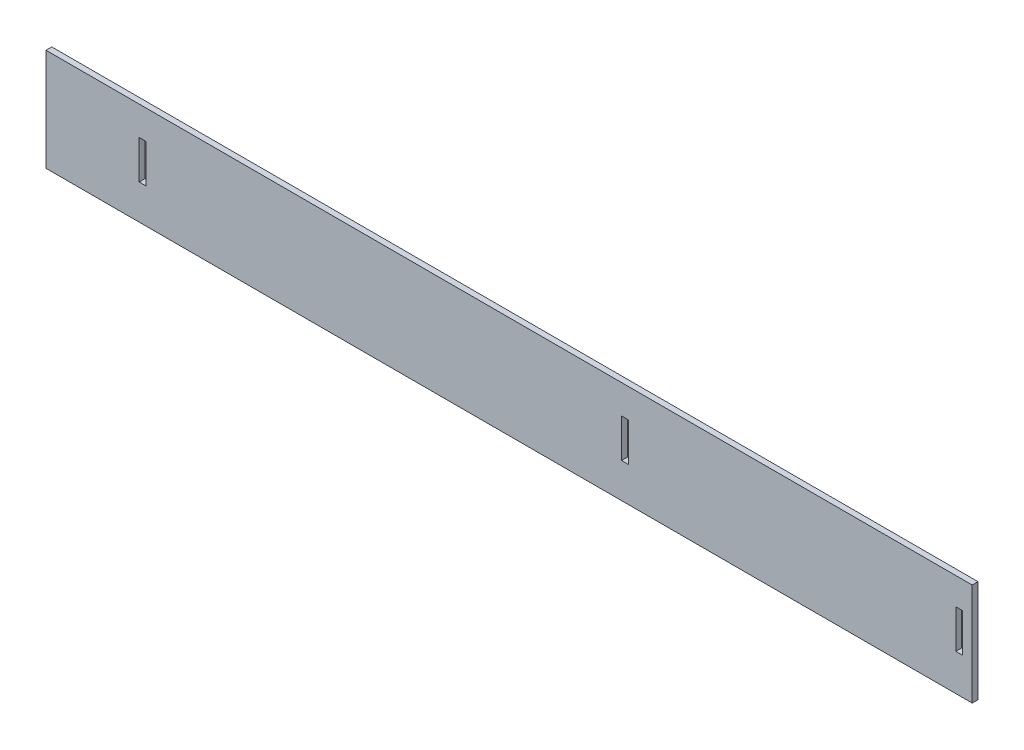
SolidWorks part; units mm, degrees
ref_plane "Plan de face" through (0, 0, 0) normal (0, 0, 1) x (1, 0, 0)
ref_plane "Plan de dessus" through (0, 0, 0) normal (0, 1, 0) x (1, 0, 0)
ref_plane "Plan de droite" through (0, 0, 0) normal (1, 0, 0) x (0, 0, -1)
sketch "Esquisse1" plane through (0, 0, 0) normal (0, 0, 1) x (1, 0, 0)
  line L0 (0, 35.9721) -> (500, 35.9721) construction
  line L1 (0, 50) -> (480, 50)
  line L2 (0, 50) -> (0, 0)
  line L13 (0, 0) -> (0, -3)
  line L14 (48.25, 35) -> (51.75, 35)
  line L15 (48.25, 35) -> (48.25, 15)
  line L16 (48.25, 15) -> (51.75, 15)
  line L17 (51.75, 35) -> (51.75, 15)
  line L18 (298.25, 35) -> (301.75, 35)
  line L19 (298.25, 35) -> (298.25, 15)
  line L20 (298.25, 15) -> (301.75, 15)
  line L21 (301.75, 35) -> (301.75, 15)
  line L22 (471.5, 35.9721) -> (475, 35.9721)
  line L23 (471.5, 35.9721) -> (471.5, 15.9721)
  line L24 (471.5, 15.9721) -> (475, 15.9721)
  line L25 (475, 35.9721) -> (475, 15.9721)
  line L26 (0, -3) -> (480, -3)
  line L27 (480, -3) -> (480, 50)
  point P24 (50, 15)
  point P29 (48.25, 25)
  dimension "D11" = 3.5
  dimension "D1" = 50
  dimension "D2" = 480
  dimension "D3" = 53
  dimension "D4" = 5
  dimension "D12" = 15
  dimension "D14" = 50
  dimension "D15" = 15
  dimension "D17" = 3.5
  dimension "D18" = 250
  dimension "D20" = 3.5
extrude "Boss.-Extru.1" add sketch "Esquisse1" along normal blind 3
